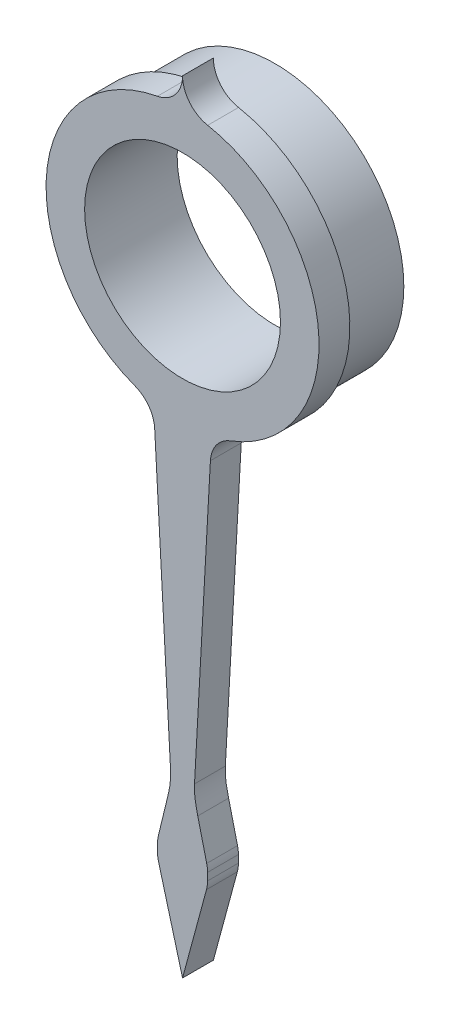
SolidWorks part; units mm, degrees
ref_plane "Спереди" through (0, 0, 0) normal (0, 0, 1) x (1, 0, 0)
ref_plane "Сверху" through (0, 0, 0) normal (0, 1, 0) x (1, 0, 0)
ref_plane "Справа" through (0, 0, 0) normal (1, 0, 0) x (0, 0, -1)
sketch "Эскиз1" plane through (0, 0, 0) normal (0, 0, 1) x (1, 0, 0)
  line L0 (0.8114, -8.7536) -> (0.8114, -8.9947)
  line L1 (-0.3881, -6.4818) -> (-0.9032, 2.8507)
  line L2 (0, -12.1263) -> (-0.7767, -9.2559)
  line L3 (-0.8114, -8.7536) -> (-0.8114, -8.9947)
  line L4 (-0.7831, -8.5172) -> (-0.4939, -7.3285)
  line L19 (0, -12.1263) -> (0.7767, -9.2559)
  line L28 (0.7831, -8.5172) -> (0.4939, -7.3285)
  line L37 (0.3881, -6.4818) -> (0.9032, 2.8507)
  line L38 (0, 15.9167) -> (0, -14.7268) construction
  line L39 (-8.4333, 7.8763) -> (8.6615, 7.8763) construction
  circle A0 centre (0, 7.8763) radius 3.175
  arc A1 (1.5512, 3.7321) -> (0.8157, 12.2255) centre (0, 7.8763) ccw
  arc A2 (0, 13.2083) -> (0.8157, 12.2255) centre (1, 13.2083) ccw
  arc A3 (0, 13.2083) -> (-0.8157, 12.2255) centre (-1, 13.2083) cw
  arc A4 (-0.8157, 12.2255) -> (-1.5512, 3.7321) centre (0, 7.8763) ccw
  arc A5 (0.9032, 2.8507) -> (1.5512, 3.7321) centre (1.9017, 2.7955) cw
  arc A6 (0.7767, -9.2559) -> (0.8114, -8.9947) centre (-0.1886, -8.9947) ccw
  arc A7 (0.8114, -8.7536) -> (0.7831, -8.5172) centre (-0.1886, -8.7536) ccw
  arc A8 (-0.9032, 2.8507) -> (-1.5512, 3.7321) centre (-1.9017, 2.7955) ccw
  arc A9 (-0.7767, -9.2559) -> (-0.8114, -8.9947) centre (0.1886, -8.9947) cw
  arc A10 (-0.8114, -8.7536) -> (-0.7831, -8.5172) centre (0.1886, -8.7536) cw
  spline S0 degree 3 poles (0.4939, -7.3285) (0.4246, -7.0438) (0.3711, -6.7905) (0.3881, -6.4818) knots 0 0 0 0 1 1 1 1
  spline S1 degree 3 poles (-0.4939, -7.3285) (-0.4246, -7.0438) (-0.3711, -6.7905) (-0.3881, -6.4818) knots 0 0 0 0 1 1 1 1
  dimension "D1" = 6.35
  dimension "D2" = 8.85
  dimension "D3" = 2
  dimension "D4" = 1
  dimension "D5" = 1
extrude "Бобышка-Вытянуть1" add sketch "Эскиз1" along normal blind 1
sketch "Эскиз2" plane through (0, 0, 0) normal (0, 0, -1) x (-1, 0, 0)
  circle A0 centre (0, 7.8763) radius 4.175
  circle A1 centre (0, 7.8763) radius 3.175 construction
  circle A2 centre (0, 7.8763) radius 3.175
  dimension "D1" = 8.35
extrude "Бобышка-Вытянуть2" add sketch "Эскиз2" along normal blind 2
